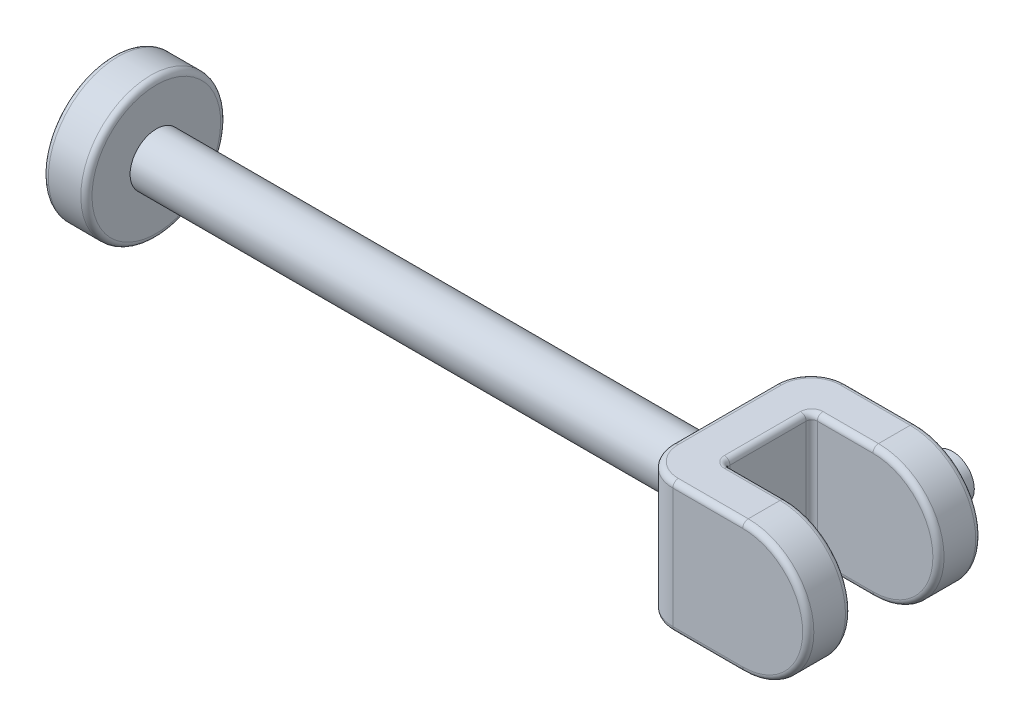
SolidWorks part; units mm, degrees
ref_plane "Front Plane" through (0, 0, 0) normal (0, 0, 1) x (1, 0, 0)
ref_plane "Top Plane" through (0, 0, 0) normal (0, 1, 0) x (1, 0, 0)
ref_plane "Right Plane" through (0, 0, 0) normal (1, 0, 0) x (0, 0, -1)
sketch "Sketch2" plane through (0, 0, 0) normal (0, 0, 1) x (1, 0, 0)
  line L0 (54.61, 0) -> (-9.723, 0) construction
  line L1 (44.45, 1.905) -> (3.175, 1.905)
  line L2 (3.175, 1.905) -> (3.175, 5.08)
  line L3 (3.175, 5.08) -> (0, 5.08)
  line L4 (0, 5.08) -> (0, 0)
  line L5 (0, 0) -> (44.45, 0)
  line L6 (44.45, 0) -> (44.45, 1.905)
  dimension "D1" = 3.175
  dimension "D2" = 3.81
  dimension "D3" = 44.45
  dimension "D4" = 10.16
  dimension "D5" = 10.16
revolve "Revolve1" add sketch "Sketch2" angle 360 about L0
sketch "Sketch3" plane through (0, 0, 0) normal (0, 0, 1) x (1, 0, 0)
  line L0 (44.45, 4.7625) -> (44.45, -4.7625)
  line L2 (44.45, -4.7625) -> (52.07, -4.7625)
  line L3 (44.45, 0) -> (52.07, 0) construction
  line L4 (44.45, 4.7625) -> (52.07, 4.7625)
  line L6 (44.45, -1.905) -> (44.45, 1.905) construction
  arc A0 (52.07, 4.7625) -> (52.07, -4.7625) centre (52.07, 0) cw
  dimension "D1" = 9.525
  dimension "D2" = 7.62
extrude "Boss-Extrude1" add sketch "Sketch3" against normal mid plane 12.573
sketch "Sketch4" plane through (0, 0, 6.2865) normal (0, 0, 1) x (1, 0, 0)
  arc A1 (52.07, -4.7625) -> (52.07, 4.7625) centre (52.07, 0) ccw construction
  circle A3 centre (52.07, 0) radius 1.5875
  dimension "D1" = 3.175
extrude "Boss-Extrude2" add sketch "Sketch4" against normal blind 15.24
fillet "Fillet1" radius 2.54 2 edges at (44.45, 0, 6.2865) (44.45, 0, -6.2865)
sketch "Sketch5" plane through (0, 4.7625, 0) normal (0, 1, 0) x (1, 0, 0)
  line L0 (0, 0) -> (60.96, 0) construction
  line L1 (60.96, 3.175) -> (47.625, 3.175)
  line L3 (47.625, 3.175) -> (47.625, -3.175)
  line L4 (60.96, -3.175) -> (47.625, -3.175)
  line L5 (60.96, 3.175) -> (60.96, -3.175)
  line L7 (44.45, 3.7465) -> (44.45, -3.7465) construction
  dimension "D1" = 6.35
  dimension "D2" = 13.335
  dimension "D3" = 3.175
extrude "Cut-Extrude1" cut sketch "Sketch5" against normal through all
fillet "Fillet2" radius 0.4064 24 edges at (56.8325, 0, -3.175) (49.8475, -4.7625, -3.175) (49.8475, 4.7625, -3.175) (47.625, -4.7625, 0) (47.625, 4.7625, 0) (56.8325, 0, -6.2865) (49.53, -4.7625, -6.2865) (45.1939, -4.7625, -5.5426) (44.45, -4.7625, 0) (45.1939, -4.7625, 5.5426) (49.53, -4.7625, 6.2865) (56.8325, 0, 6.2865) (49.53, 4.7625, 6.2865) (45.1939, 4.7625, 5.5426) (44.45, 4.7625, 0) (45.1939, 4.7625, -5.5426) (49.8475, -4.7625, 3.175) (49.8475, 4.7625, 3.175) (0, 5.08, 0) (3.175, 5.08, 0) (49.53, 4.7625, -6.2865) (56.8325, 0, 3.175) (47.625, 0, 3.175) (47.625, 0, -3.175)
